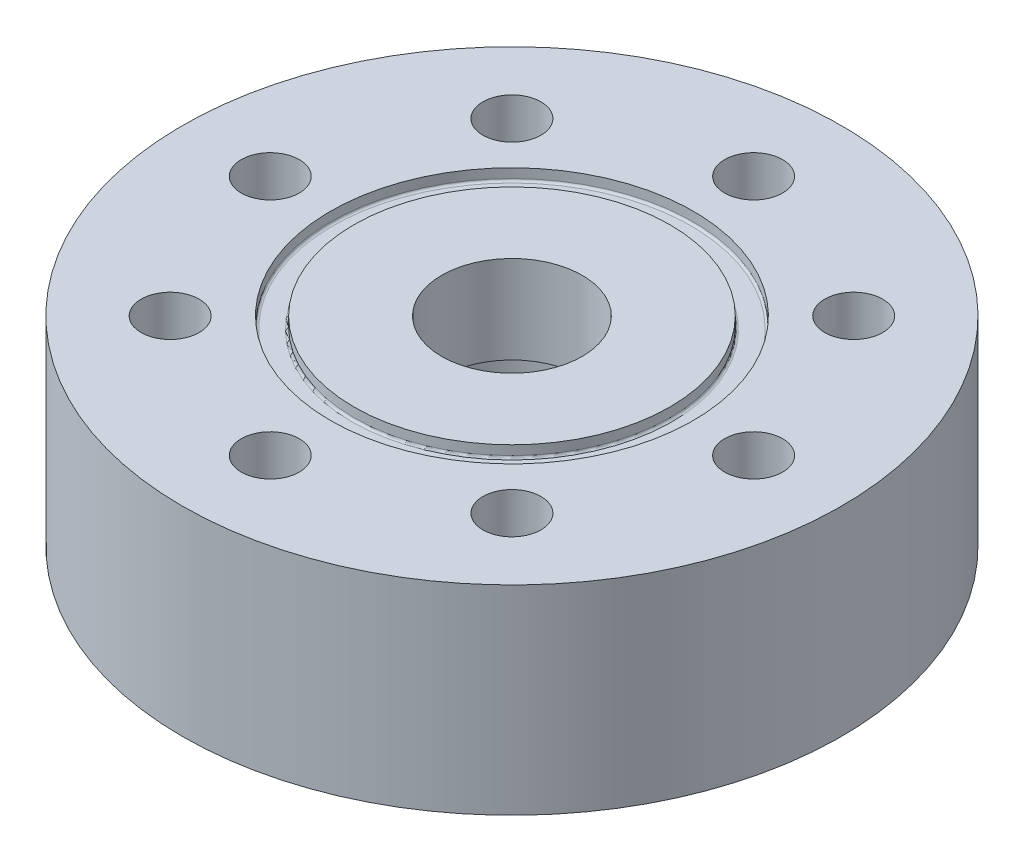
SolidWorks part; units mm, degrees
ref_plane "Front Plane" through (0, 0, 0) normal (0, 0, 1) x (1, 0, 0)
ref_plane "Top Plane" through (0, 0, 0) normal (0, 1, 0) x (1, 0, 0)
ref_plane "Right Plane" through (0, 0, 0) normal (1, 0, 0) x (0, 0, -1)
sketch "Sketch2" plane through (0, 0, 0) normal (0, 1, 0) x (1, 0, 0)
  circle A0 centre (0, 0) radius 37.5
  dimension "D1" = 75
extrude "Outer Cylinder" add sketch "Sketch2" along normal blind 22.7
sketch "Sketch3" plane through (0, 0, 0) normal (0, -1, 0) x (1, 0, 0)
  circle A0 centre (0, 0) radius 8.93
  dimension "D1" = 17.86
extrude "NPT Hole" cut sketch "Sketch3" against normal blind 12.7
sketch "Sketch4" plane through (0, 0, 0) normal (0, -1, 0) x (1, 0, 0)
  circle A0 centre (-27.5, 0) radius 3.3
  circle A1 centre (-19.4454, 19.4454) radius 3.3
  circle A2 centre (0, 27.5) radius 3.3
  circle A3 centre (19.4454, 19.4454) radius 3.3
  circle A4 centre (27.5, 0) radius 3.3
  circle A5 centre (19.4454, -19.4454) radius 3.3
  circle A6 centre (0, -27.5) radius 3.3
  circle A7 centre (-19.4454, -19.4454) radius 3.3
  point P19 (0, 0)
  dimension "D1" = 6.6
  dimension "D2" = 27.5
  dimension "D3" = 8
extrude "Bolt Holes" cut sketch "Sketch4" against normal through all
sketch "Sketch5" plane through (0, 22.7, 0) normal (0, 1, 0) x (1, 0, 0)
  circle A0 centre (0, 0) radius 17.9705
  circle A1 centre (0, 0) radius 20.6375
  dimension "D1" = 41.275
  dimension "D2" = 2.667
extrude "O-Ring Groove" cut sketch "Sketch5" against normal blind 1.3208
fillet "Fillet1" radius 0.254 2 edges at (0, 21.3792, 17.9705) (0, 21.3792, 20.6375)
sketch "Sketch6" plane through (0, 22.7, 0) normal (0, 1, 0) x (1, 0, 0)
  circle A0 centre (0, 0) radius 8
extrude "Inlet Flow Diameter" cut sketch "Sketch6" against normal blind 10
equation "\"D\"= 16"
equation "\"Inlet Flow Diameter\"= \"D\""
equation "\"D1@Sketch6\"=\"D\""
